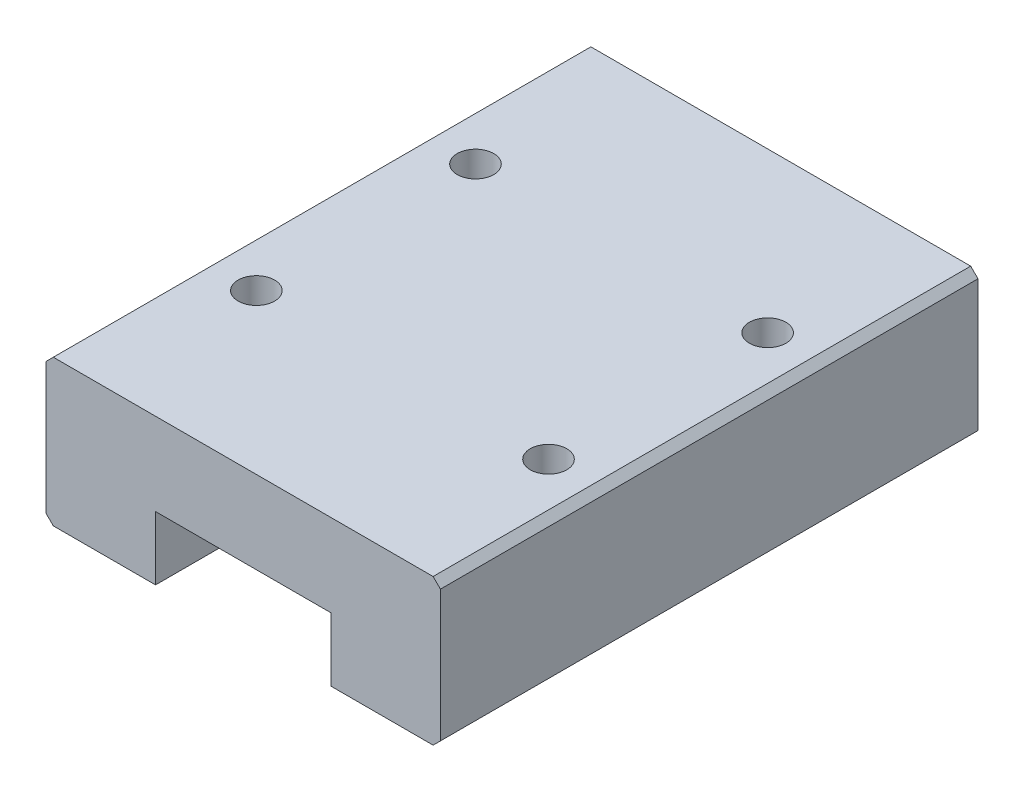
SolidWorks part; units mm, degrees
ref_plane "前视基准面" through (0, 0, 0) normal (0, 0, 1) x (1, 0, 0)
ref_plane "上视基准面" through (0, 0, 0) normal (0, 1, 0) x (1, 0, 0)
ref_plane "右视基准面" through (0, 0, 0) normal (1, 0, 0) x (0, 0, -1)
sketch "草图1" plane through (0, 0, 0) normal (0, 0, 1) x (1, 0, 0)
  line L0 (27, 0.5) -> (26.5, 0)
  line L1 (26.5, 10) -> (27, 9.5)
  line L2 (0.5, 10) -> (0, 9.5)
  line L3 (0.5, 0) -> (0, 0.5)
  line L4 (19.5, 0) -> (26.5, 0)
  line L5 (7.5, 0) -> (7.5, 4.35)
  line L6 (19.5, 0) -> (19.5, 4.35)
  line L7 (0.5, 0) -> (7.5, 0)
  line L8 (7.5, 4.35) -> (19.5, 4.35)
  line L9 (0, 0.5) -> (0, 9.5)
  line L10 (27, 0.5) -> (27, 9.5)
  line L11 (0.5, 10) -> (26.5, 10)
extrude "凸台-拉伸1" add sketch "草图1" along normal blind 36.8
sketch "草图2" plane through (0, 10, 0) normal (0, 1, 0) x (1, 0, 0)
  circle A0 centre (3.5, -25.9) radius 1.25
  circle A1 centre (23.5, -25.9) radius 1.25
  circle A2 centre (23.5, -10.9) radius 1.25
  circle A3 centre (3.5, -10.9) radius 1.25
extrude "切除-拉伸1" cut sketch "草图2" against normal blind 36.8
